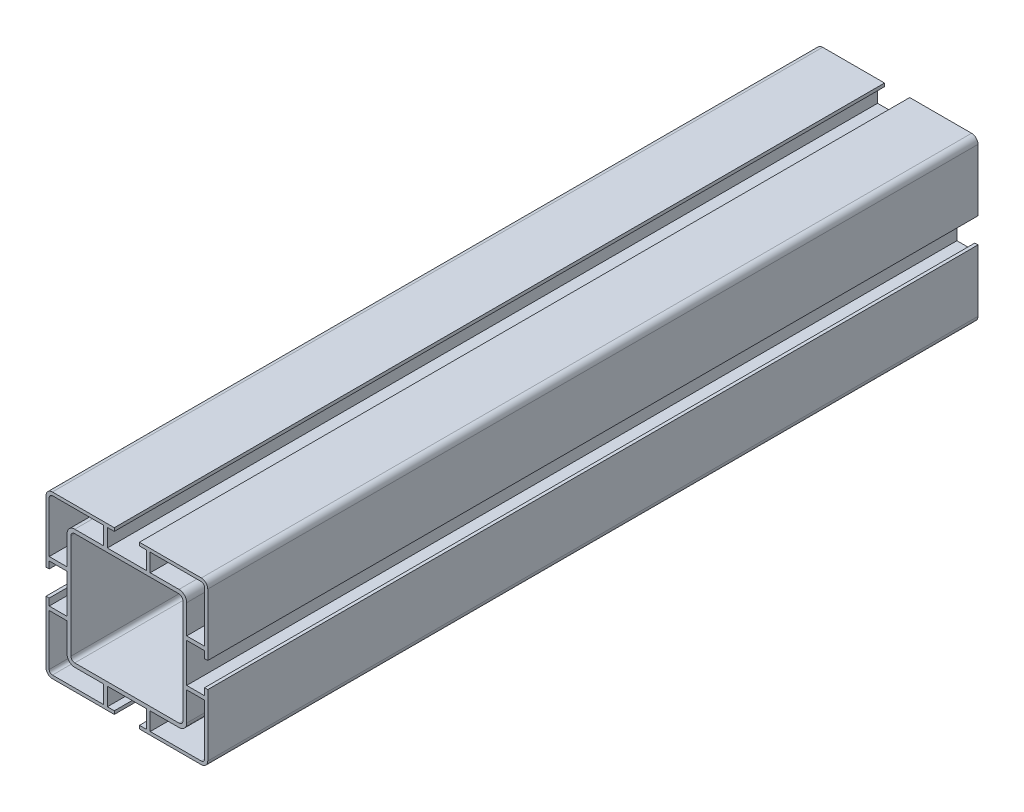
SolidWorks part; units mm, degrees
ref_plane "前视基准面" through (0, 0, 0) normal (0, 0, 1) x (1, 0, 0)
ref_plane "上视基准面" through (0, 0, 0) normal (0, 1, 0) x (1, 0, 0)
ref_plane "右视基准面" through (0, 0, 0) normal (1, 0, 0) x (0, 0, -1)
sketch "Model" plane through (0, 0, 0) normal (0, 0, 1) x (1, 0, 0)
  line L0 (4962.1555, 295.8066) -> (4946.9555, 295.8066)
  line L1 (4946.9555, 295.8066) -> (4946.9555, 302.7566)
  line L2 (4962.1555, 295.8066) -> (4962.1555, 302.7566)
  line L3 (4949.6555, 302.7566) -> (4946.9555, 302.7566)
  line L4 (4959.4555, 302.7566) -> (4962.1555, 302.7566)
  line L5 (4949.6555, 304.0066) -> (4949.6555, 302.7566)
  line L6 (4959.4555, 304.0066) -> (4959.4555, 302.7566)
  line L7 (4949.6555, 304.0066) -> (4925.5555, 304.0066)
  line L8 (4959.4555, 304.0066) -> (4983.5555, 304.0066)
  line L9 (4923.0555, 277.4066) -> (4923.0555, 301.5066)
  line L10 (4986.0555, 277.4066) -> (4986.0555, 301.5066)
  line L11 (4923.0555, 277.4066) -> (4924.3055, 277.4066)
  line L12 (4986.0555, 277.4066) -> (4984.8055, 277.4066)
  line L13 (4924.3055, 277.4066) -> (4924.3055, 280.1066)
  line L14 (4984.8055, 277.4066) -> (4984.8055, 280.1066)
  line L15 (4931.2555, 280.1066) -> (4924.3055, 280.1066)
  line L16 (4977.8555, 280.1066) -> (4984.8055, 280.1066)
  line L17 (4931.2555, 264.9066) -> (4931.2555, 280.1066)
  line L18 (4977.8555, 280.1066) -> (4977.8555, 264.9066)
  line L19 (4931.2555, 264.9066) -> (4924.3055, 264.9066)
  line L20 (4977.8555, 264.9066) -> (4984.8055, 264.9066)
  line L21 (4924.3055, 267.6066) -> (4924.3055, 264.9066)
  line L22 (4984.8055, 267.6066) -> (4984.8055, 264.9066)
  line L23 (4923.0555, 267.6066) -> (4924.3055, 267.6066)
  line L24 (4986.0555, 267.6066) -> (4984.8055, 267.6066)
  line L25 (4923.0555, 267.6066) -> (4923.0555, 243.5066)
  line L26 (4986.0555, 267.6066) -> (4986.0555, 243.5066)
  line L27 (4949.6555, 241.0066) -> (4925.5555, 241.0066)
  line L28 (4959.4555, 241.0066) -> (4983.5555, 241.0066)
  line L29 (4949.6555, 241.0066) -> (4949.6555, 242.2566)
  line L30 (4959.4555, 241.0066) -> (4959.4555, 242.2566)
  line L31 (4949.6555, 242.2566) -> (4946.9555, 242.2566)
  line L32 (4959.4555, 242.2566) -> (4962.1555, 242.2566)
  line L33 (4946.9555, 249.2066) -> (4946.9555, 242.2566)
  line L34 (4962.1555, 249.2066) -> (4962.1555, 242.2566)
  line L35 (4962.1555, 249.2066) -> (4946.9555, 249.2066)
  line L36 (4934.2555, 249.2066) -> (4945.4555, 249.2066)
  line L37 (4931.2555, 263.4066) -> (4931.2555, 252.2066)
  line L38 (4945.4555, 249.2066) -> (4945.4555, 242.2566)
  line L39 (4924.3055, 263.4066) -> (4931.2555, 263.4066)
  line L40 (4945.4555, 242.2566) -> (4925.5555, 242.2566)
  line L41 (4924.3055, 243.5066) -> (4924.3055, 263.4066)
  line L42 (4974.8555, 295.8066) -> (4963.6555, 295.8066)
  line L43 (4977.8555, 281.6066) -> (4977.8555, 292.8066)
  line L44 (4963.6555, 295.8066) -> (4963.6555, 302.7566)
  line L45 (4984.8055, 281.6066) -> (4977.8555, 281.6066)
  line L46 (4963.6555, 302.7566) -> (4983.5555, 302.7566)
  line L47 (4984.8055, 301.5066) -> (4984.8055, 281.6066)
  line L48 (4934.2555, 294.3066) -> (4974.8555, 294.3066)
  line L49 (4976.3555, 292.8066) -> (4976.3555, 252.2066)
  line L50 (4932.7555, 252.2066) -> (4932.7555, 292.8066)
  line L51 (4974.8555, 250.7066) -> (4934.2555, 250.7066)
  line L52 (4931.2555, 292.8066) -> (4931.2555, 281.6066)
  line L53 (4945.4555, 295.8066) -> (4934.2555, 295.8066)
  line L54 (4931.2555, 281.6066) -> (4924.3055, 281.6066)
  line L55 (4945.4555, 302.7566) -> (4945.4555, 295.8066)
  line L56 (4924.3055, 281.6066) -> (4924.3055, 301.5066)
  line L57 (4925.5555, 302.7566) -> (4945.4555, 302.7566)
  line L58 (4977.8555, 252.2066) -> (4977.8555, 263.4066)
  line L59 (4963.6555, 249.2066) -> (4974.8555, 249.2066)
  line L60 (4977.8555, 263.4066) -> (4984.8055, 263.4066)
  line L61 (4963.6555, 242.2566) -> (4963.6555, 249.2066)
  line L62 (4984.8055, 263.4066) -> (4984.8055, 243.5066)
  line L63 (4983.5555, 242.2566) -> (4963.6555, 242.2566)
  arc A0 (4925.5555, 304.0066) -> (4923.0555, 301.5066) centre (4925.5555, 301.5066) ccw
  arc A1 (4986.0555, 301.5066) -> (4983.5555, 304.0066) centre (4983.5555, 301.5066) ccw
  arc A2 (4923.0555, 243.5066) -> (4925.5555, 241.0066) centre (4925.5555, 243.5066) ccw
  arc A3 (4983.5555, 241.0066) -> (4986.0555, 243.5066) centre (4983.5555, 243.5066) ccw
  arc A4 (4931.2555, 252.2066) -> (4934.2555, 249.2066) centre (4934.2555, 252.2066) ccw
  arc A5 (4924.3055, 243.5066) -> (4925.5555, 242.2566) centre (4925.5555, 243.5066) ccw
  arc A6 (4977.8555, 292.8066) -> (4974.8555, 295.8066) centre (4974.8555, 292.8066) ccw
  arc A7 (4984.8055, 301.5066) -> (4983.5555, 302.7566) centre (4983.5555, 301.5066) ccw
  arc A8 (4976.3555, 292.8066) -> (4974.8555, 294.3066) centre (4974.8555, 292.8066) ccw
  arc A9 (4934.2555, 294.3066) -> (4932.7555, 292.8066) centre (4934.2555, 292.8066) ccw
  arc A10 (4974.8555, 250.7066) -> (4976.3555, 252.2066) centre (4974.8555, 252.2066) ccw
  arc A11 (4932.7555, 252.2066) -> (4934.2555, 250.7066) centre (4934.2555, 252.2066) ccw
  arc A12 (4934.2555, 295.8066) -> (4931.2555, 292.8066) centre (4934.2555, 292.8066) ccw
  arc A13 (4925.5555, 302.7566) -> (4924.3055, 301.5066) centre (4925.5555, 301.5066) ccw
  arc A14 (4974.8555, 249.2066) -> (4977.8555, 252.2066) centre (4974.8555, 252.2066) ccw
  arc A15 (4983.5555, 242.2566) -> (4984.8055, 243.5066) centre (4983.5555, 243.5066) ccw
extrude "凸台-拉伸1" add sketch "Model" along normal blind 300
